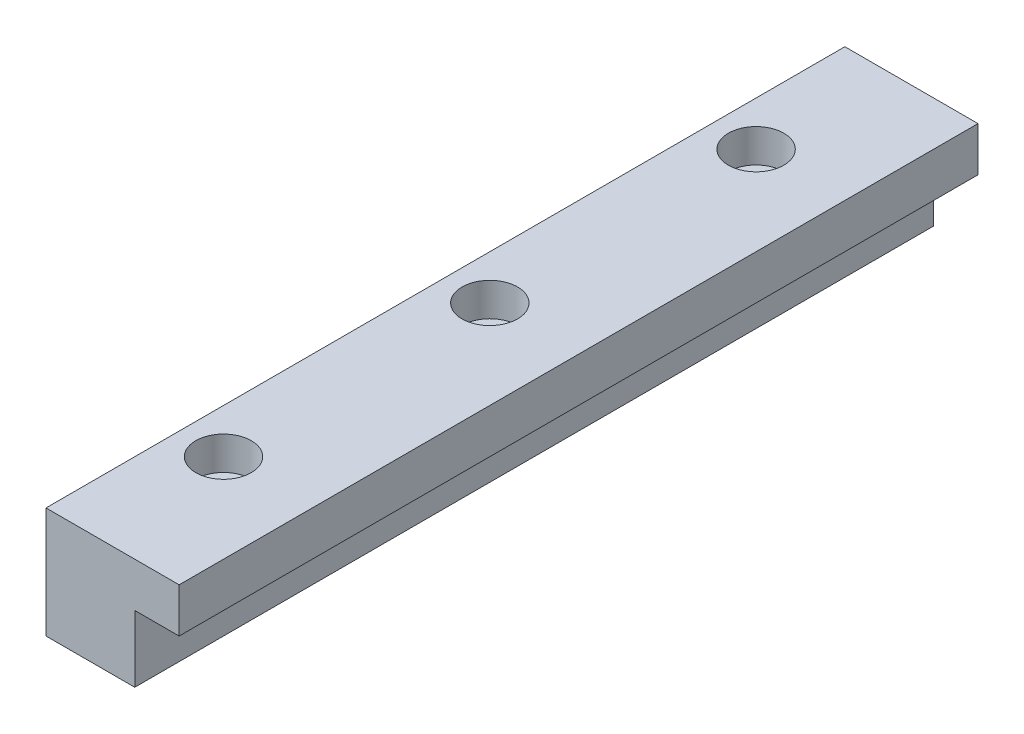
SolidWorks part; units mm, degrees
ref_plane "Front Plane" through (0, 0, 0) normal (0, 0, 1) x (1, 0, 0)
ref_plane "Top Plane" through (0, 0, 0) normal (0, 1, 0) x (1, 0, 0)
ref_plane "Right Plane" through (0, 0, 0) normal (1, 0, 0) x (0, 0, -1)
sketch "Sketch1" plane through (0, 0, 0) normal (0, 0, 1) x (1, 0, 0)
  line L0 (-19.05, -15.875) -> (-19.05, 15.875)
  line L1 (-19.05, 15.875) -> (19.05, 15.875)
  line L2 (19.05, 15.875) -> (19.05, 3.175)
  line L3 (19.05, 3.175) -> (6.35, 3.175)
  line L4 (6.35, -15.875) -> (6.35, 3.175)
  line L5 (6.35, -15.875) -> (-19.05, -15.875)
  point P7 (-19.05, 0)
  point P9 (0, 15.875)
  dimension "H" = 31.75
  dimension "A" = 19.05
  dimension "W" = 38.1
  dimension "B" = 12.7
extrude "Extrude1" add sketch "Sketch1" along normal mid plane 228.6
hole_wizard "CBORE for 5/8 Socket Head Cap Screw_E" positions "3DSketch3" profile "Sketch9" counterbore size "3/8" standard "Ansi Inch"
sketch3d "3DSketch3"
  line L6 (6.35, 15.875, 114.3) -> (6.35, 15.875, -114.3) construction
  line L9 (19.05, 15.875, 114.3) -> (-19.05, 15.875, 114.3) construction
  line L10 (19.05, 15.875, -114.3) -> (-19.05, 15.875, -114.3) construction
  line L11 (-6.35, 15.875, 76.2) -> (-6.35, 15.875, -114.3) construction
  point P2 (-6.35, 15.875, 76.2)
  dimension "D" = 12.7
  dimension "E" = 38.1
sketch "Sketch9" plane through (-6.35, 15.875, 76.2) normal (1, 0, 0) x (0, 0, 1)
  line L0 (0, 0) -> (0, 31.75)
  line L1 (0, 31.75) -> (5.0419, 31.75)
  line L3 (5.0419, 31.75) -> (5.0419, 9.525)
  line L4 (5.0419, 9.525) -> (7.9375, 9.525)
  line L5 (7.9375, 9.525) -> (7.9375, 0)
  line L7 (7.9375, 0) -> (0, 0)
  line L11 (0, -6.35) -> (0, 107.95) construction
  dimension "Thru Hole Dia." = 10.0838
  dimension "Thru Hole Depth" = 31.75
  dimension "C'Bore Dia." = 15.875
  dimension "C'Bore Depth" = 9.525
hole_wizard "CBORE for 5/8 Socket Head Cap Screw_F" positions "3DSketch4" profile "Sketch10" counterbore size "3/8" standard "Ansi Inch"
sketch3d "3DSketch4"
  line L0 (-4.953, 11.176, 127) -> (-4.953, 11.176, -158.75) construction
  line L1 (15.875, 11.176, 158.75) -> (-15.875, 11.176, 158.75) construction
  point P0 (-4.953, 11.176, 63.5)
  dimension "F" = 0
sketch "Sketch10" plane through (-4.953, 11.176, 63.5) normal (1, 0, 0) x (0, 0, 1)
  line L0 (0, 0) -> (0, 22.352)
  line L1 (0, 22.352) -> (5.0419, 22.352)
  line L3 (5.0419, 22.352) -> (5.0419, 9.525)
  line L4 (5.0419, 9.525) -> (7.9375, 9.525)
  line L5 (7.9375, 9.525) -> (7.9375, 0)
  line L7 (7.9375, 0) -> (0, 0)
  line L11 (0, -6.35) -> (0, 107.95) construction
  dimension "Thru Hole Dia." = 10.0838
  dimension "Thru Hole Depth" = 22.352
  dimension "C'Bore Dia." = 15.875
  dimension "C'Bore Depth" = 9.525
hole_wizard "CBORE for 5/8 Socket Head Cap Screw_G" positions "3DSketch5" profile "Sketch11" counterbore size "3/8" standard "Ansi Inch"
sketch3d "3DSketch5"
  line L0 (-6.35, 15.875, 76.2) -> (-6.35, 15.875, -114.3) construction
  line L1 (19.05, 15.875, 114.3) -> (-19.05, 15.875, 114.3) construction
  point P0 (-6.35, 15.875, 0)
  dimension "G" = 114.3
sketch "Sketch11" plane through (-6.35, 15.875, 0) normal (1, 0, 0) x (0, 0, 1)
  line L0 (0, 0) -> (0, 31.75)
  line L1 (0, 31.75) -> (5.0419, 31.75)
  line L3 (5.0419, 31.75) -> (5.0419, 9.525)
  line L4 (5.0419, 9.525) -> (7.9375, 9.525)
  line L5 (7.9375, 9.525) -> (7.9375, 0)
  line L7 (7.9375, 0) -> (0, 0)
  line L11 (0, -6.35) -> (0, 107.95) construction
  dimension "Thru Hole Dia." = 10.0838
  dimension "Thru Hole Depth" = 31.75
  dimension "C'Bore Dia." = 15.875
  dimension "C'Bore Depth" = 9.525
hole_wizard "CBORE for 5/8 Socket Head Cap Screw_J" positions "3DSketch6" profile "Sketch12" counterbore size "3/8" standard "Ansi Inch"
sketch3d "3DSketch6"
  line L0 (-4.953, 11.176, 127) -> (-4.953, 11.176, -158.75) construction
  line L1 (15.875, 11.176, 158.75) -> (-15.875, 11.176, 158.75) construction
  point P0 (-4.953, 11.176, -63.5)
  dimension "J" = 0
sketch "Sketch12" plane through (-4.953, 11.176, -63.5) normal (1, 0, 0) x (0, 0, 1)
  line L0 (0, 0) -> (0, 22.352)
  line L1 (0, 22.352) -> (5.0419, 22.352)
  line L3 (5.0419, 22.352) -> (5.0419, 9.525)
  line L4 (5.0419, 9.525) -> (7.9375, 9.525)
  line L5 (7.9375, 9.525) -> (7.9375, 0)
  line L7 (7.9375, 0) -> (0, 0)
  line L11 (0, -6.35) -> (0, 107.95) construction
  dimension "Thru Hole Dia." = 10.0838
  dimension "Thru Hole Depth" = 22.352
  dimension "C'Bore Dia." = 15.875
  dimension "C'Bore Depth" = 9.525
hole_wizard "CBORE for 5/8 Socket Head Cap Screw_K" positions "3DSketch7" profile "Sketch13" counterbore size "3/8" standard "Ansi Inch"
sketch3d "3DSketch7"
  line L0 (-6.35, 15.875, 76.2) -> (-6.35, 15.875, -114.3) construction
  line L1 (19.05, 15.875, 114.3) -> (-19.05, 15.875, 114.3) construction
  point P0 (-6.35, 15.875, -76.2)
  dimension "K" = 190.5
sketch "Sketch13" plane through (-6.35, 15.875, -76.2) normal (1, 0, 0) x (0, 0, 1)
  line L0 (0, 0) -> (0, 31.75)
  line L1 (0, 31.75) -> (5.0419, 31.75)
  line L3 (5.0419, 31.75) -> (5.0419, 9.525)
  line L4 (5.0419, 9.525) -> (7.9375, 9.525)
  line L5 (7.9375, 9.525) -> (7.9375, 0)
  line L7 (7.9375, 0) -> (0, 0)
  line L11 (0, -6.35) -> (0, 107.95) construction
  dimension "Thru Hole Dia." = 10.0838
  dimension "Thru Hole Depth" = 31.75
  dimension "C'Bore Dia." = 15.875
  dimension "C'Bore Depth" = 9.525
